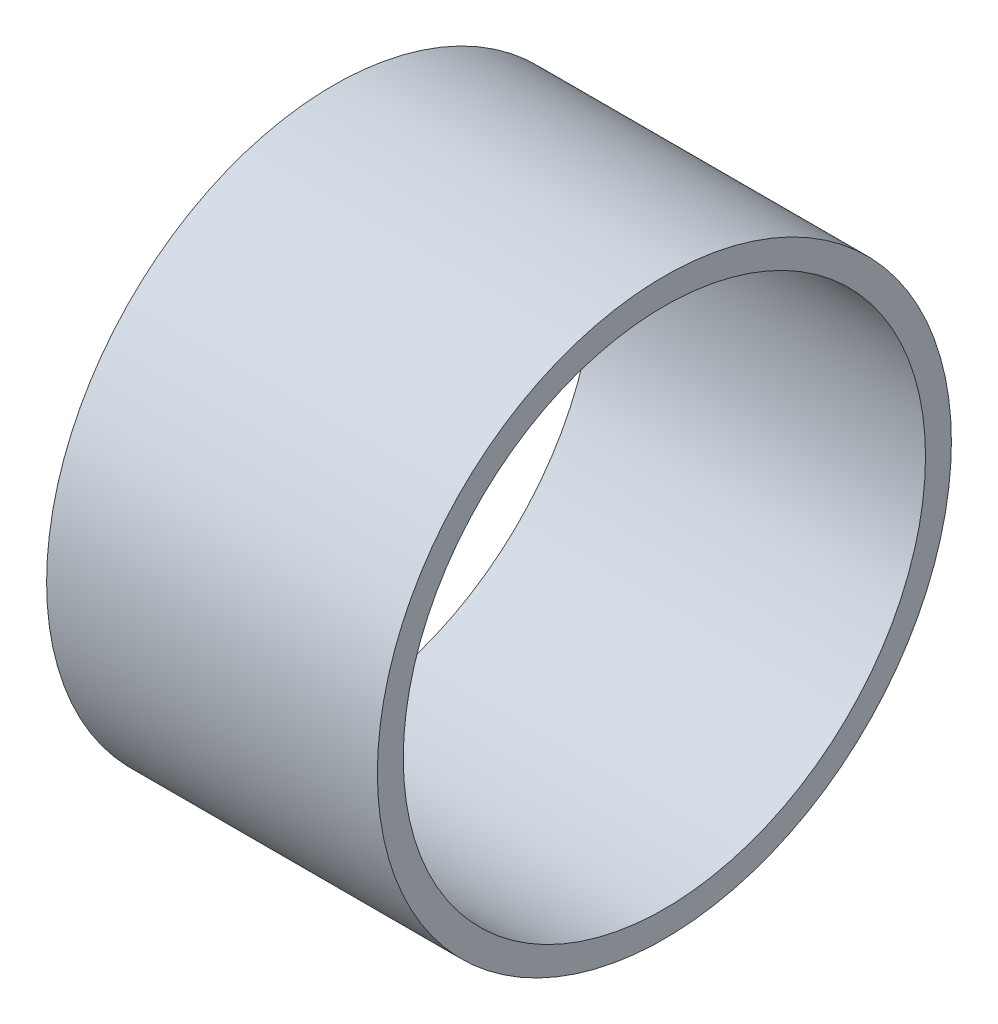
SolidWorks part; units mm, degrees
ref_plane "Plan de face" through (0, 0, 0) normal (0, 0, 1) x (1, 0, 0)
ref_plane "Plan de dessus" through (0, 0, 0) normal (0, 1, 0) x (1, 0, 0)
ref_plane "Plan de droite" through (0, 0, 0) normal (1, 0, 0) x (0, 0, -1)
sketch "Esquisse1" plane through (-898.8974, 0, 0) normal (1, 0, 0) x (0, 0, -1)
  circle A0 centre (-1000, -877.9045) radius 69.85
  dimension "D1" = 139.7
extrude "Extru.-Mince1" add sketch "Esquisse1" against normal blind 80.5 thin
